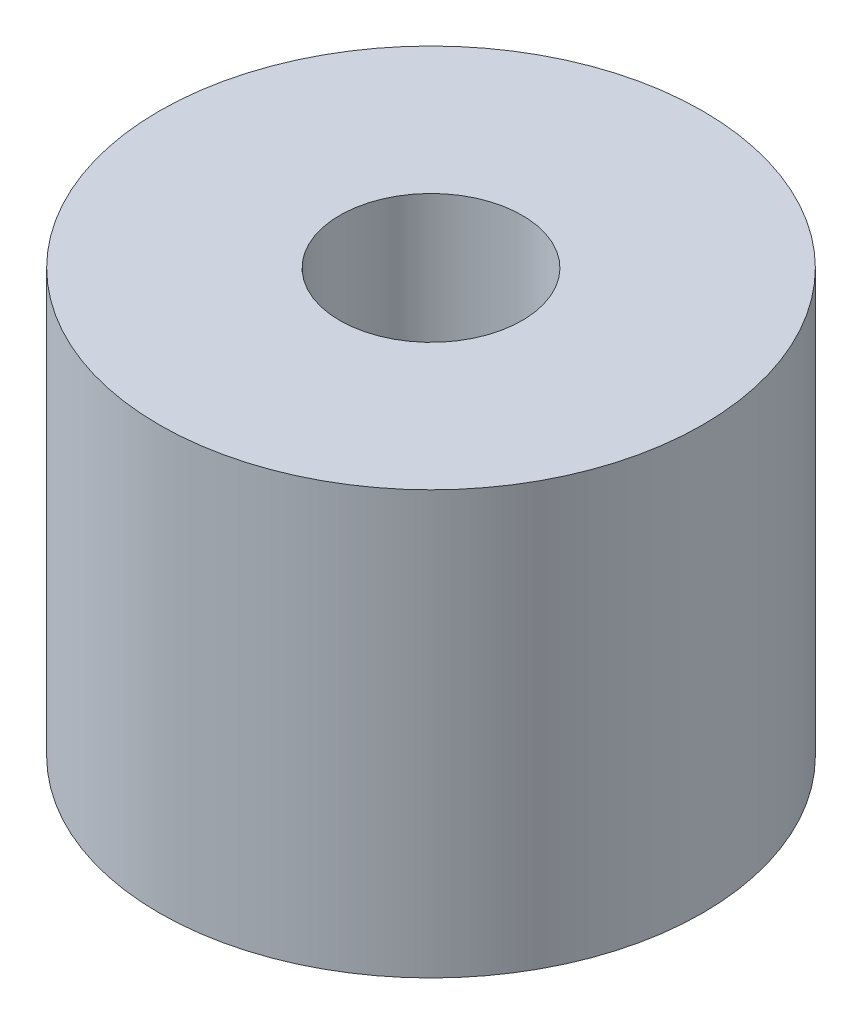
SolidWorks part; units mm, degrees
ref_plane "Front Plane" through (0, 0, 0) normal (0, 0, 1) x (1, 0, 0)
ref_plane "Top Plane" through (0, 0, 0) normal (0, 1, 0) x (1, 0, 0)
ref_plane "Right Plane" through (0, 0, 0) normal (1, 0, 0) x (0, 0, -1)
sketch "Sketch1" plane through (0, 0, 0) normal (0, 1, 0) x (1, 0, 0)
  circle A0 centre (0, 0) radius 22.5
  dimension "D1" = 45
extrude "Boss-Extrude1" add sketch "Sketch1" along normal blind 35
sketch "Sketch2" plane through (0, 35, 0) normal (0, 1, 0) x (1, 0, 0)
  circle A0 centre (0, 0) radius 7.55
  dimension "D1" = 15.1
extrude "Cut-Extrude1" cut sketch "Sketch2" against normal blind 25
hole_wizard "CBORE for M6 SHCS1" positions "Sketch4" profile "Sketch3" counterbore size "M6" standard "ANSI Metric"
sketch "Sketch4" plane through (0, 10, 0) normal (0, 1, 0) x (1, 0, 0)
  point P0 (0, 0)
sketch "Sketch3" plane through (0, 10, 0) normal (1, 0, 0) x (0, 0, 1)
  line L0 (0, 0) -> (0, 10)
  line L1 (0, 10) -> (3.3, 10)
  line L3 (3.3, 10) -> (3.3, 7)
  line L4 (3.3, 7) -> (5.5, 7)
  line L5 (5.5, 7) -> (5.5, 0)
  line L7 (5.5, 0) -> (0, 0)
  line L11 (0, -6.35) -> (0, 107.95) construction
  dimension "Thru Hole Dia." = 6.6
  dimension "Thru Hole Depth" = 10
  dimension "C'Bore Dia." = 11
  dimension "C'Bore Depth" = 7
